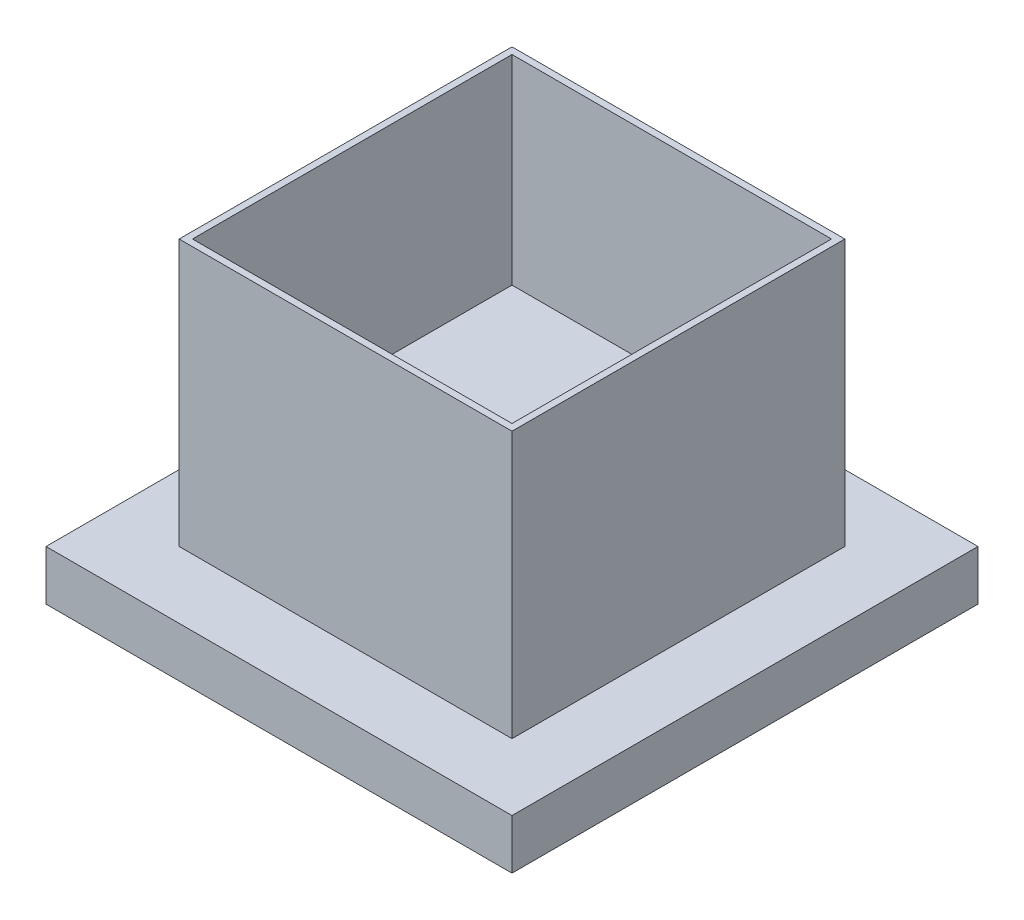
SolidWorks part; units mm, degrees
ref_plane "Alzado" through (0, 0, 0) normal (0, 0, 1) x (1, 0, 0)
ref_plane "Planta" through (0, 0, 0) normal (0, 1, 0) x (1, 0, 0)
ref_plane "Vista lateral" through (0, 0, 0) normal (1, 0, 0) x (0, 0, -1)
sketch "Croquis1" plane through (0, 0, 0) normal (0, 1, 0) x (1, 0, 0)
  line L1 (0, 0) -> (70, 0)
  line L2 (0, 0) -> (0, 70)
  line L3 (0, 70) -> (70, 70)
  line L4 (70, 0) -> (70, 70)
  dimension "D1" = 70
  dimension "D2" = 70
extrude "Saliente-Extruir1" add sketch "Croquis1" along normal blind 7.5
sketch "Croquis2" plane through (0, 7.5, 0) normal (0, 1, 0) x (1, 0, 0)
  line L8 (10, 60) -> (10, 10)
  line L9 (10, 10) -> (60, 10)
  line L10 (60, 10) -> (60, 60)
  line L11 (60, 60) -> (10, 60)
  line L12 (10, 60) -> (10, 10)
  line L13 (10, 10) -> (60, 10)
  line L14 (60, 10) -> (60, 60)
  line L15 (60, 60) -> (10, 60)
  dimension "D1" = 10
extrude "Saliente-Extruir2" add sketch "Croquis2" along normal blind 40
sketch "Croquis3" plane through (0, 47.5, 0) normal (0, 1, 0) x (1, 0, 0)
  line L8 (59, 59) -> (11, 59)
  line L9 (11, 59) -> (11, 11)
  line L10 (11, 11) -> (59, 11)
  line L11 (59, 11) -> (59, 59)
  line L12 (59, 59) -> (11, 59)
  line L13 (11, 59) -> (11, 11)
  line L14 (11, 11) -> (59, 11)
  line L15 (59, 11) -> (59, 59)
  dimension "D1" = 1
extrude "Cortar-Extruir1" cut sketch "Croquis3" against normal blind 30
sketch "Croquis5" plane through (0, 0, 0) normal (0, -1, 0) x (1, 0, 0)
  line L0 (34.6875, -65) -> (34.6875, -30) construction
  line L1 (70, -70) -> (0, -70) construction
  line L3 (0, 0) -> (70, 0) construction
  line L8 (34.6875, -30.3673) -> (34.6875, -64.6327)
  arc A0 (33.5612, -64.2855) -> (33.5612, -30.7145) centre (45, -47.5) cw
  arc A2 (34.6875, -30.3673) -> (33.5612, -30.7145) centre (34.6875, -32.3673) ccw
  arc A3 (34.6875, -64.6327) -> (33.5612, -64.2855) centre (34.6875, -62.6327) cw
  point P2 (0, 0)
  point P3 (0, 0)
  point P9 (34.6875, -30)
  point P10 (0, 0)
  dimension "D4" = 2
  dimension "D2" = 30
revolve "Cortar-Revolución1" cut sketch "Croquis5" angle 360 about L0
ref_plane "Plano1" through (0, 0, -40) normal (0, 0, -1) x (-1, 0, 0)
sketch "Croquis6" plane through (0, 0, -40) normal (0, 0, -1) x (-1, 0, 0)
  line L0 (-54.5062, 0) -> (-28.6249, 0)
  line L1 (-70, 0) -> (0, 0) construction
ref_plane "Plano2" through (0, -17.3205, -30) normal (0, -0.5, -0.866) x (-1, 0, 0)
sketch "Croquis7" plane through (0, -17.3205, -30) normal (0, -0.5, -0.866) x (-1, 0, 0)
  line L1 (-21.9929, 15.1836) -> (-46.3158, 15.1836)
  line L2 (-21.9929, 15.1836) -> (-21.9929, 31.2161)
  line L3 (-21.9929, 31.2161) -> (-46.3158, 31.2161)
  line L4 (-46.3158, 15.1836) -> (-46.3158, 31.2161)
  ellipse E1 centre (-34.6875, 16.1836) end of major axis (-32.6875, 16.1836) minor radius 1 (-35.8138, 15.3573) -> (-33.5612, 15.3573) ccw construction
  point P4 (-21.9929, 11.9862)
  point P11 (-24.9682, 22.0674)
extrude "Saliente-Extruir3" add sketch "Croquis7" against normal up to next
sketch "Croquis9" plane through (21.9929, 0, 0) normal (-1, 0, 0) x (0, 0, 1)
  line L0 (-70, 0) -> (0, 0) construction
  line L1 (-42.1637, 0) -> (-27.338, 0)
  line L2 (-42.1637, 0) -> (-42.1637, -13.6103)
  line L3 (-42.1637, -13.6103) -> (-27.338, -13.6103)
  line L4 (-27.338, 0) -> (-27.338, -13.6103)
extrude "Cortar-Extruir2" cut sketch "Croquis9" against normal through all
